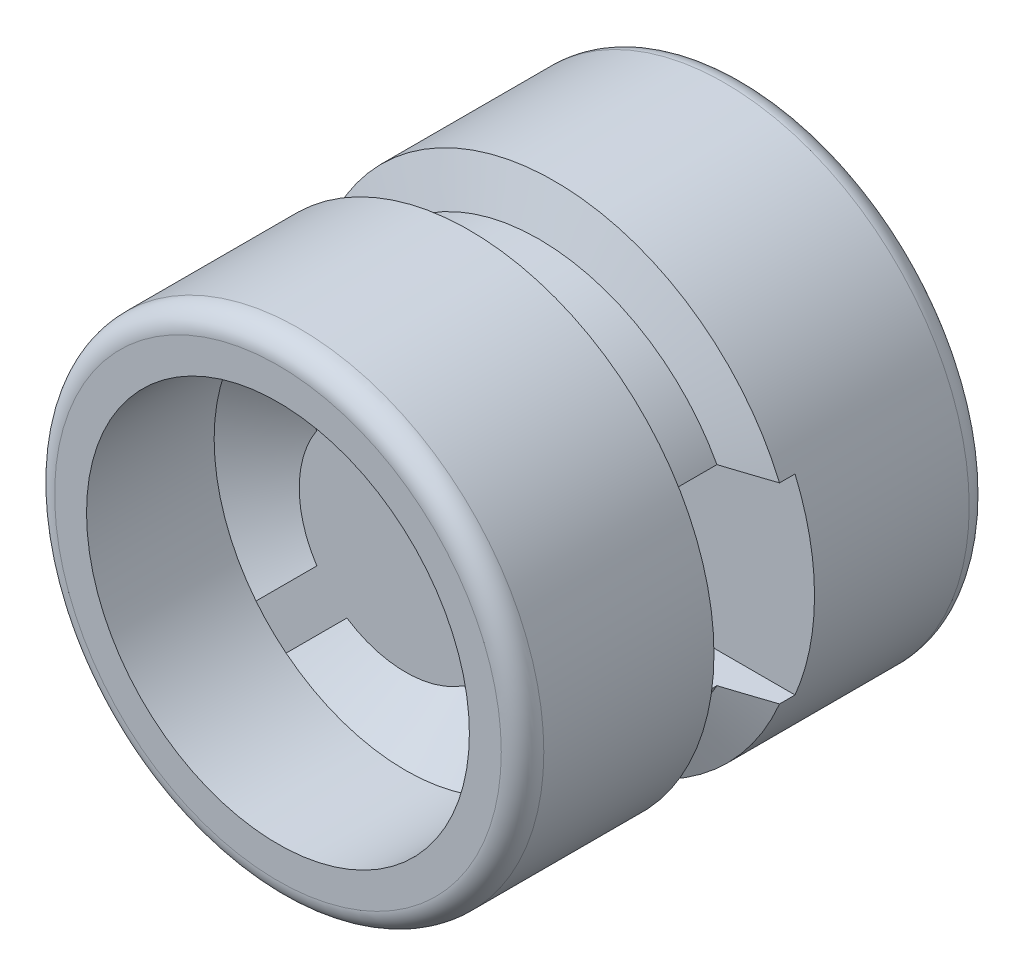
SolidWorks part; units mm, degrees
ref_plane "Face" through (0, 0, 0) normal (0, 0, 1) x (1, 0, 0)
ref_plane "Dessus" through (0, 0, 0) normal (0, 1, 0) x (1, 0, 0)
ref_plane "Droite" through (0, 0, 0) normal (1, 0, 0) x (0, 0, -1)
sketch "Esquisse2" plane through (0, 0, 0) normal (1, 0, 0) x (0, 0, -1)
  line L0 (-5.5, 0) -> (-5.5, 5.75)
  line L1 (-5.5, 0) -> (5.5, 0)
  line L2 (-5.5, 5.75) -> (-1, 5.75)
  line L3 (-1, 5.75) -> (-0.636, 4.75)
  line L4 (-0.636, 4.75) -> (0.636, 4.75)
  line L5 (0.636, 4.75) -> (1, 5.75)
  line L6 (1, 5.75) -> (5.5, 5.75)
  line L7 (5.5, 5.75) -> (5.5, 0)
  line L8 (-7.1929, 0) -> (7.1182, 0) construction
  dimension "D1" = 11
  dimension "D2" = 5.75
  dimension "D3" = 4.75
  dimension "D4" = 4.5
  dimension "D5" = 4.5
  dimension "D6" = 70
  dimension "D7" = 110
revolve "Base-Révolution" add sketch "Esquisse2" angle 360 about L8
sketch "Esquisse4" plane through (0, 0, 0) normal (1, 0, 0) x (0, 0, -1)
  line L1 (1.364, 2.25) -> (-0.636, 2.25)
  line L2 (1.364, 2.25) -> (1.364, -2.25)
  line L3 (1.364, -2.25) -> (-0.636, -2.25)
  line L4 (-0.636, 2.25) -> (-0.636, -2.25)
  line L6 (-0.636, 4.75) -> (-0.636, -4.75) construction
  dimension "D1" = 2
  dimension "D2" = 4.5
extrude "Enlèv. mat.-Extru.1" cut sketch "Esquisse4" against normal mid plane 12
sketch "Esquisse6" plane through (0, 0, -5.5) normal (0, 0, -1) x (-1, 0, 0)
  circle A0 centre (0, 0) radius 1.5
  dimension "D1" = 3
extrude "Enlèv. mat.-Extru.3" cut sketch "Esquisse6" against normal up to vertex
sketch "Esquisse7" plane through (0, 0, -5.5) normal (0, 0, -1) x (-1, 0, 0)
  circle A0 centre (0, 0) radius 4.5
  circle A1 centre (0, 0) radius 3
  dimension "D1" = 6
  dimension "D2" = 9
extrude "Enlèv. mat.-Extru.4" cut sketch "Esquisse7" against normal blind 2.5
sketch "Esquisse8" plane through (0, 0, 5.5) normal (0, 0, 1) x (1, 0, 0)
  line L0 (5.5561, 0) -> (-7.0553, 0) construction
  line L1 (0, 0) -> (-3.9191, -3.9191) construction
  line L2 (0, 0) -> (3.6864, -3.6864) construction
  line L3 (0, 0) -> (-3.727, 3.727) construction
  line L4 (0, 0) -> (2.8856, 2.8856) construction
  line L5 (1.3785, 2.0856) -> (2.8087, 3.5158)
  line L6 (2.0856, 1.3785) -> (3.5158, 2.8087)
  line L7 (2.0856, -1.3785) -> (3.5158, -2.8087)
  line L8 (1.3785, -2.0856) -> (2.8087, -3.5158)
  line L9 (-2.8087, -3.5158) -> (-1.3785, -2.0856)
  line L10 (-2.0856, -1.3785) -> (-3.5158, -2.8087)
  line L11 (-2.0856, 1.3785) -> (-3.5158, 2.8087)
  line L12 (-1.3785, 2.0856) -> (-2.8087, 3.5158)
  arc A0 (-1.3785, -2.0856) -> (1.3785, -2.0856) centre (0, 0) ccw
  arc A1 (-2.8087, -3.5158) -> (2.8087, -3.5158) centre (0, 0) ccw
  arc A2 (-2.0856, 1.3785) -> (-2.0856, -1.3785) centre (0, 0) ccw
  arc A3 (2.0856, -1.3785) -> (2.0856, 1.3785) centre (0, 0) ccw
  arc A4 (1.3785, 2.0856) -> (-1.3785, 2.0856) centre (0, 0) ccw
  arc A5 (3.5158, -2.8087) -> (3.5158, 2.8087) centre (0, 0) ccw
  arc A6 (2.8087, 3.5158) -> (-2.8087, 3.5158) centre (0, 0) ccw
  arc A7 (-3.5158, 2.8087) -> (-3.5158, -2.8087) centre (0, 0) ccw
  dimension "D1" = 5
  dimension "D2" = 9
  dimension "D4" = 0.5
  dimension "D3" = 135
  dimension "D5" = 0.5
  dimension "D6" = 0.5
  dimension "D7" = 0.5
  dimension "D8" = 0.5
  dimension "D9" = 0.5
  dimension "D10" = 1
  dimension "D11" = 1
extrude "Enlèv. mat.-Extru.5" cut sketch "Esquisse8" against normal blind 4.5
sketch "Esquisse10" plane through (0, 0, 5.5) normal (0, 0, 1) x (1, 0, 0)
  line L0 (-2.8087, 3.5158) -> (-1.3785, 2.0856)
  line L1 (1.3785, 2.0856) -> (2.8087, 3.5158)
  line L2 (2.0856, 1.3785) -> (3.5158, 2.8087)
  line L3 (2.0856, -1.3785) -> (3.5158, -2.8087)
  line L4 (2.8087, -3.5158) -> (1.3785, -2.0856)
  line L5 (-1.3785, -2.0856) -> (-2.8087, -3.5158)
  line L6 (-3.5158, -2.8087) -> (-2.0856, -1.3785)
  line L7 (-2.0856, 1.3785) -> (-3.5158, 2.8087)
  arc A0 (2.8087, -3.5158) -> (3.5158, -2.8087) centre (0, 0) ccw
  arc A1 (1.3785, 2.0856) -> (-1.3785, 2.0856) centre (0, 0) ccw
  arc A2 (3.5158, 2.8087) -> (2.8087, 3.5158) centre (0, 0) ccw
  arc A3 (-2.8087, 3.5158) -> (-3.5158, 2.8087) centre (0, 0) ccw
  arc A4 (-3.5158, -2.8087) -> (-2.8087, -3.5158) centre (0, 0) ccw
  arc A5 (-2.0856, 1.3785) -> (-2.0856, -1.3785) centre (0, 0) ccw
  arc A6 (-1.3785, -2.0856) -> (1.3785, -2.0856) centre (0, 0) ccw
  arc A7 (2.0856, -1.3785) -> (2.0856, 1.3785) centre (0, 0) ccw
extrude "Enlèv. mat.-Extru.6" cut sketch "Esquisse10" against normal blind 3
draft "Dépouille5" type of draft neutral plane draft angle 45 faces to draft 1 parameters "D1"=45
sketch "Esquisse11" plane through (0, 0, 2.5) normal (0, 0, 1) x (1, 0, 0)
  circle A0 centre (0, 0) radius 4.5
  circle A1 centre (0, 0) radius 5.75
extrude "Boss.-Extru.1" add sketch "Esquisse11" along normal blind 3
sketch "Esquisse12" plane through (0, 0, 1) normal (0, 0, 1) x (1, 0, 0)
  line L0 (-2.4452, 1.7381) -> (-2.0856, 1.3785)
  line L1 (-2.0856, -1.3785) -> (-2.4452, -1.7381)
  line L2 (2.0856, -1.3785) -> (2.4452, -1.7381)
  line L3 (2.4452, 1.7381) -> (2.0856, 1.3785)
  arc A0 (2.4452, -1.7381) -> (2.4452, 1.7381) centre (0, 0) ccw
  arc A1 (2.0856, -1.3785) -> (2.0856, 1.3785) centre (0, 0) ccw
  arc A2 (-2.0856, 1.3785) -> (-2.0856, -1.3785) centre (0, 0) ccw
  arc A3 (-2.4452, 1.7381) -> (-2.4452, -1.7381) centre (0, 0) ccw
extrude "Enlèv. mat.-Extru.7" cut sketch "Esquisse12" against normal blind 1
fillet "Congé1" radius 0.5 2 edges at (5.75, 0, 5.5) (5.75, 0, -5.5)
